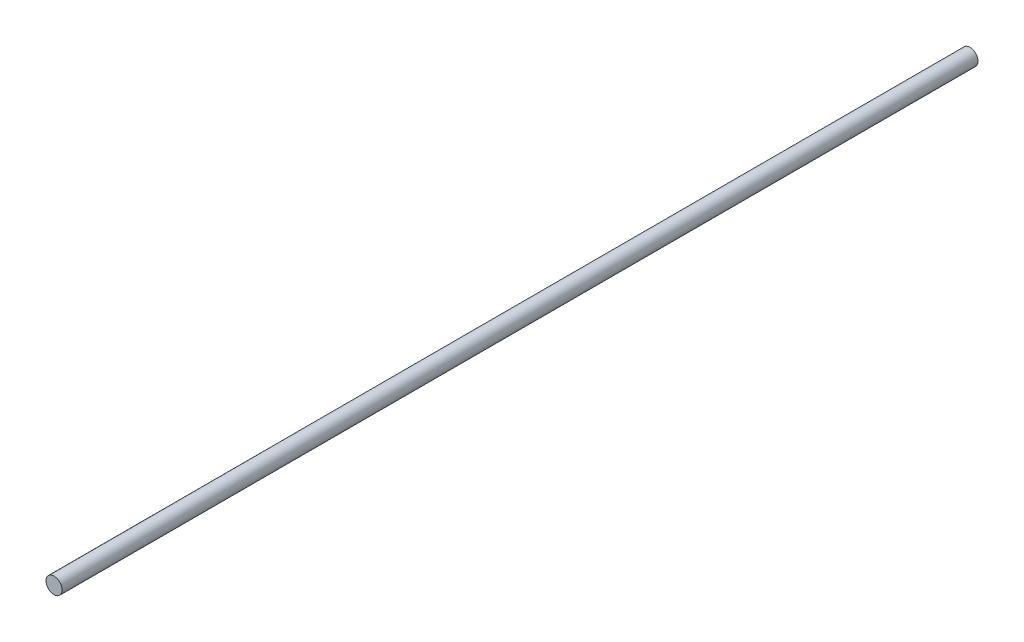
SolidWorks part; units mm, degrees
ref_plane "Plan de face" through (0, 0, 0) normal (0, 0, 1) x (1, 0, 0)
ref_plane "Plan de dessus" through (0, 0, 0) normal (0, 1, 0) x (1, 0, 0)
ref_plane "Plan de droite" through (0, 0, 0) normal (1, 0, 0) x (0, 0, -1)
sketch "Esquisse1" plane through (0, 0, 0) normal (0, 0, 1) x (1, 0, 0)
  circle A0 centre (0, 0) radius 3
  dimension "D1" = 6
extrude "Boss.-Extru.1" add sketch "Esquisse1" along normal blind 340.5
